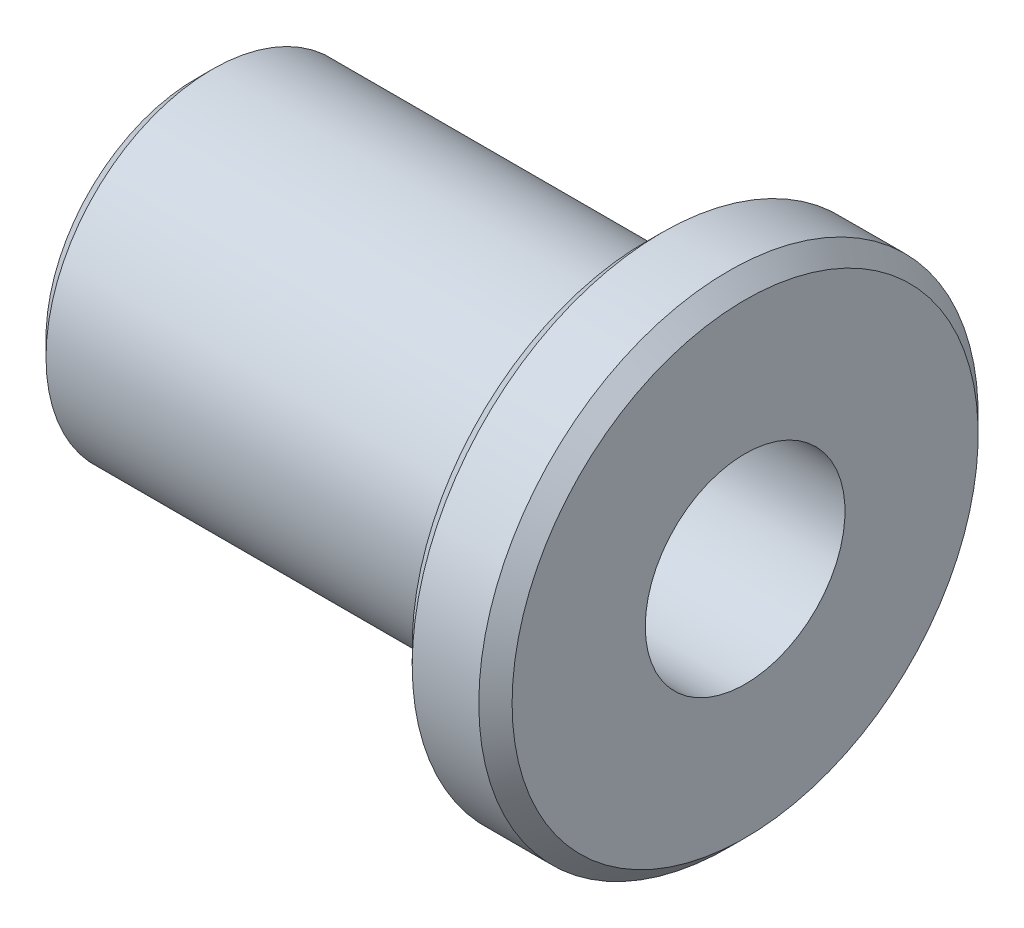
SolidWorks part; units mm, degrees
ref_plane "Plan1" through (0, 0, 0) normal (0, 0, 1) x (1, 0, 0)
ref_plane "Plan2" through (0, 0, 0) normal (0, 1, 0) x (1, 0, 0)
ref_plane "Plan3" through (0, 0, 0) normal (1, 0, 0) x (0, 0, -1)
sketch "Esquisse1" plane through (0, 0, 0) normal (0, 0, 1) x (1, 0, 0)
  line L0 (0, 0) -> (36.6906, 0) construction
  line L1 (0, 3) -> (0, 5)
  line L2 (0, 5) -> (13.5, 5)
  line L3 (13.5, 5) -> (13.5, 7.5)
  line L4 (13.5, 7.5) -> (16.5, 7.5)
  line L5 (16.5, 7.5) -> (16.5, 3)
  line L6 (16.5, 3) -> (0, 3)
  dimension "D1" = 3
  dimension "D2" = 7.5
  dimension "D3" = 5
  dimension "D4" = 3
  dimension "D5" = 13.5
revolve "Base-Révolution" add sketch "Esquisse1" angle 360 about L0
chamfer "Chanfrein1" distance 0.5 angle 45 4 edges at (16.5, 0, 7.5) (13.5, 0, 7.5) (0, 0, 5) (0, 0, 3)
sketch "Esq_WRNL_Compact001" plane through (0, 0, 0) normal (0, 0, 1) x (1, 0, 0)
  line L0 (-1, -8.5) -> (-1, 8.5)
  line L1 (17.5, -8.5) -> (17.5, 8.5)
  line L2 (-1, -8.5) -> (17.5, -8.5)
  line L3 (-1, 8.5) -> (17.5, 8.5)
